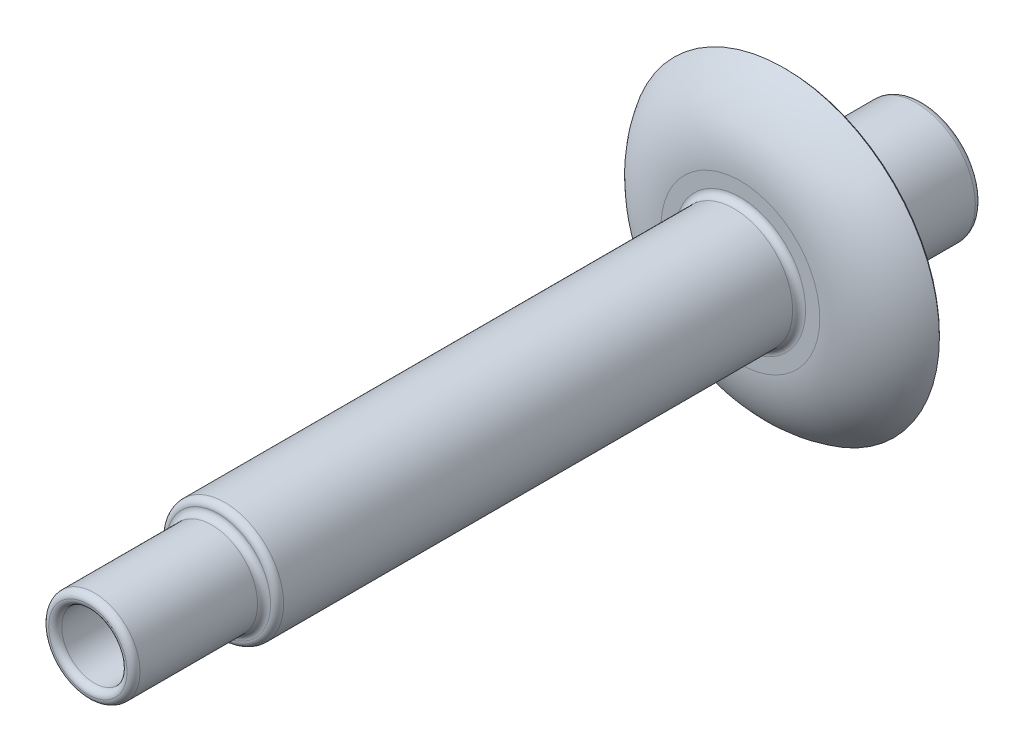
SolidWorks part; units mm, degrees
ref_plane "Спереди" through (0, 0, 0) normal (0, 0, 1) x (1, 0, 0)
ref_plane "Сверху" through (0, 0, 0) normal (0, 1, 0) x (1, 0, 0)
ref_plane "Справа" through (0, 0, 0) normal (1, 0, 0) x (0, 0, -1)
sketch "Эскиз1" plane through (0, 0, 0) normal (1, 0, 0) x (0, 0, -1)
  line L0 (-32, 0) -> (32, 0) construction
  line L1 (-32, 2.5) -> (32, 2.5)
  line L2 (32, 2.5) -> (32, 4.5)
  line L3 (32, 4.5) -> (21.5, 4.5)
  line L4 (21.5, 4.5) -> (21.5, 12)
  line L5 (-32, 2.5) -> (-32, 3.5)
  line L6 (-32, 3.5) -> (-22, 3.5)
  line L7 (-22, 3.5) -> (-22, 4.5)
  line L8 (-22, 4.5) -> (18, 4.5)
  line L9 (18, 4.5) -> (18, 10.4597) construction
  line L10 (18, 6.0839) -> (18, 4.5)
  arc A0 (21.5, 12) -> (18, 6.0839) centre (24.75, 6.0839) ccw
  dimension "D9" = 13.5
  dimension "D1" = 7
  dimension "D2" = 5
  dimension "D3" = 9
  dimension "D4" = 10
  dimension "D5" = 10.5
  dimension "D6" = 50
  dimension "D7" = 64
  dimension "D8" = 24
revolve "Повернуть1" add sketch "Эскиз1" angle 360 about L0
sketch "Эскиз2" plane through (0, 0, 0) normal (0, 0, 1) x (1, 0, 0)
  line L0 (0, 0) -> (0, 7.5) construction
  line L1 (0, 0) -> (7.5, 0) construction
  circle A0 centre (0, 0) radius 7.5 construction
  circle A1 centre (0, 7.5) radius 0.75
  circle A2 centre (7.5, 0) radius 0.75
  circle A3 centre (0, -7.5) radius 0.75
  circle A4 centre (-7.5, 0) radius 0.75
  dimension "D1" = 15
  dimension "D2" = 1.5
sketch "Эскиз3" plane through (0, 0, -21.5) normal (0, 0, -1) x (-1, 0, 0)
  circle A3 centre (7.5, 0) radius 0.75
  circle A4 centre (7.5, 0) radius 0.75
  circle A5 centre (0, -7.5) radius 0.75
  circle A6 centre (0, -7.5) radius 0.75
  circle A7 centre (-7.5, 0) radius 0.75
  circle A8 centre (-7.5, 0) radius 0.75
  circle A9 centre (0, 7.5) radius 0.75
  circle A10 centre (0, 7.5) radius 0.75
  dimension "D2" = 0
  dimension "D3" = 0
  dimension "D4" = 0
  dimension "D5" = 0
extrude "Вырез-Вытянуть2" cut sketch "Эскиз3" against normal blind 2.5
fillet "Скругление1" radius 0.5 8 edges at (3.5, 0, 22) (3.5, 0, 32) (4.5, 0, -18) (4.5, 0, 22) (4.5, 0, -32) (4.5, 0, -21.5) (2.5, 0, 32) (2.5, 0, -32)
chamfer "Фаска1" distance 0.25 angle 45 9 edges at (-0.75, -7.5, -21.5) (-0.75, -7.5, -19) (-8.25, 0, -21.5) (-8.25, 0, -19) (-0.75, 7.5, -21.5) (-0.75, 7.5, -19) (6.75, 0, -21.5) (6.75, 0, -19) (12, 0, -21.5)
